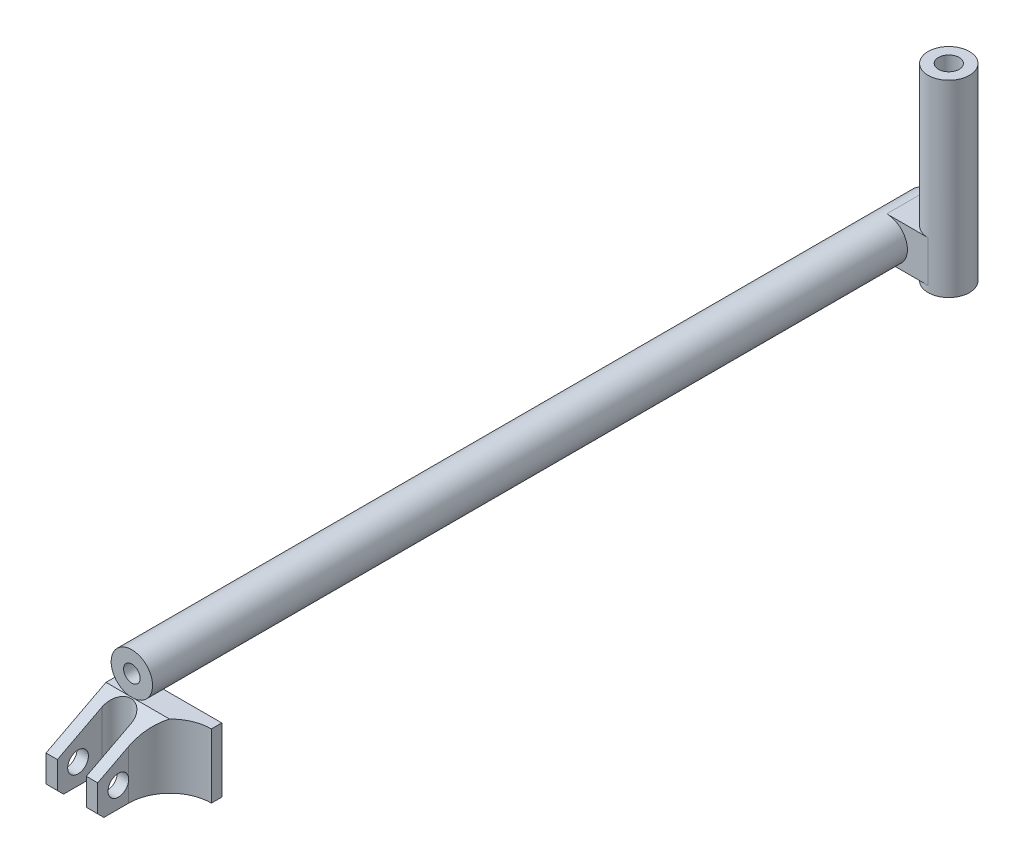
SolidWorks part; units mm, degrees
ref_plane "Plan de face" through (0, 0, 0) normal (0, 0, 1) x (1, 0, 0)
ref_plane "Plan de dessus" through (0, 0, 0) normal (0, 1, 0) x (1, 0, 0)
ref_plane "Plan de droite" through (0, 0, 0) normal (1, 0, 0) x (0, 0, -1)
mirrored part "bras telescopique_Rendre symétrique"
other "<bras telescopique>-<Extrusion7>"
